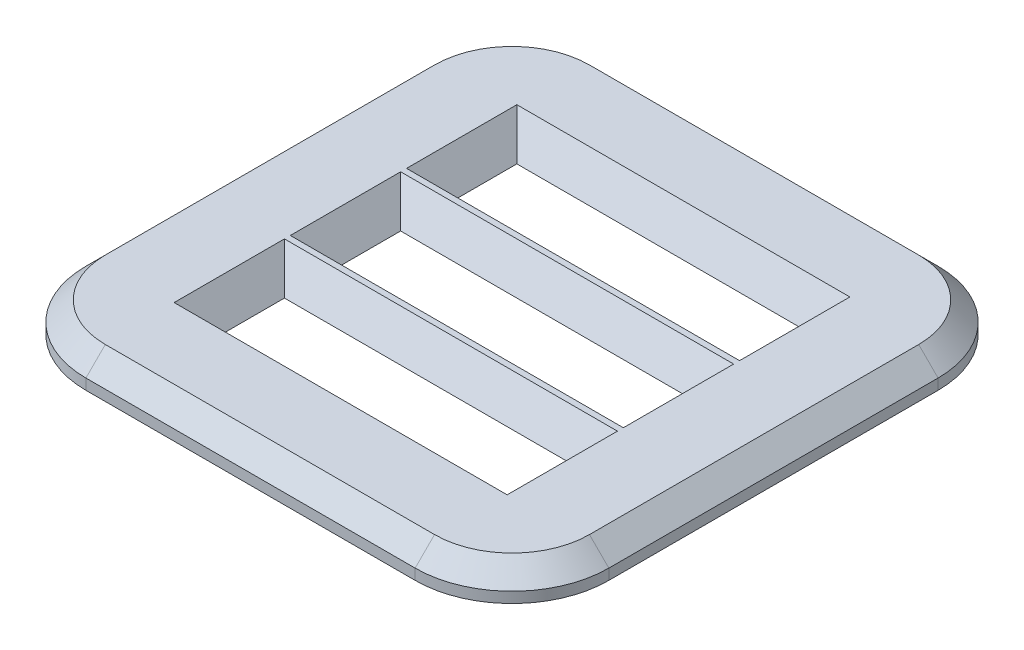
SolidWorks part; units mm, degrees
ref_plane "Front Plane" through (0, 0, 0) normal (0, 0, 1) x (1, 0, 0)
ref_plane "Top Plane" through (0, 0, 0) normal (0, 1, 0) x (1, 0, 0)
ref_plane "Right Plane" through (0, 0, 0) normal (1, 0, 0) x (0, 0, -1)
sketch "Sketch1" plane through (0, 0, 0) normal (0, 1, 0) x (1, 0, 0)
  line L1 (2.7, 2.7) -> (-2.7, 2.7)
  line L2 (2.7, 2.7) -> (2.7, -2.7)
  line L3 (2.7, -2.7) -> (-2.7, -2.7)
  line L4 (-2.7, 2.7) -> (-2.7, -2.7)
  line L5 (2.7, 2.7) -> (-2.7, -2.7) construction
  line L6 (2.7, -2.7) -> (-2.7, 2.7) construction
  point P0 (0, 0)
  dimension "D1" = 5.4
  dimension "D2" = 5.4
extrude "Boss-Extrude1" add sketch "Sketch1" along normal blind 0.31
fillet "Fillet1" radius 1 4 edges at (-2.7, 0.155, -2.7) (2.7, 0.155, -2.7) (2.7, 0.155, 2.7) (-2.7, 0.155, 2.7)
chamfer "Chamfer1" distance 0.2 angle 45 8 edges at (2.4071, 0.31, 2.4071) (0, 0.31, 2.7) (-2.4071, 0.31, 2.4071) (-2.7, 0.31, 0) (-2.4071, 0.31, -2.4071) (0, 0.31, -2.7) (2.4071, 0.31, -2.4071) (2.7, 0.31, 0)
sketch "Sketch2" plane through (0, 0.31, 0) normal (0, 1, 0) x (1, 0, 0)
  line L0 (-1.8586, 0.6) -> (1.8881, 0.6) construction
  line L1 (1.5, 0.35) -> (-1.5, 0.35)
  line L2 (1.5, 0.35) -> (1.5, -0.35)
  line L3 (1.5, -0.35) -> (-1.5, -0.35)
  line L4 (-1.5, 0.35) -> (-1.5, -0.35)
  line L5 (1.5, 0.35) -> (-1.5, -0.35) construction
  line L6 (1.5, -0.35) -> (-1.5, 0.35) construction
  line L7 (-1.7, 2.7) -> (1.7, 2.7) construction
  line L8 (-2.5, 0) -> (2.5, 0) construction
  line L9 (-2.5, 1.7) -> (-2.5, -1.7) construction
  line L10 (2.5, -1.7) -> (2.5, 1.7) construction
  line L15 (2.7, 1.7) -> (2.7, -1.7) construction
  line L16 (1.5, 1.55) -> (-1.5, 1.55)
  line L17 (-1.5, 0.85) -> (-1.5, 1.55)
  line L18 (1.5, 0.85) -> (-1.5, 0.85)
  line L19 (1.5, 0.85) -> (1.5, 1.55)
  line L20 (1.5, -0.85) -> (1.5, -1.55)
  line L21 (1.5, -0.85) -> (-1.5, -0.85)
  line L22 (-1.5, -0.85) -> (-1.5, -1.55)
  line L23 (1.5, -1.55) -> (-1.5, -1.55)
  point P0 (0, 0)
  point P20 (0, 0)
  dimension "D1" = 3
  dimension "D2" = 0.7
  dimension "D3" = 2.35
  dimension "D4" = 2.7
  dimension "D5" = 0.25
extrude "Cut-Extrude1" cut sketch "Sketch2" against normal through all
chamfer "Chamfer2" distance 0.31 angle 35.3 12 edges at (1.5, 0.31, 0) (0, 0.31, 0.35) (-1.5, 0.31, 0) (0, 0.31, -0.35) (0, 0.31, -1.55) (-1.5, 0.31, -1.2) (-1.5, 0.31, 1.2) (0, 0.31, 1.55) (1.5, 0.31, 1.2) (0, 0.31, 0.85) (1.5, 0.31, -1.2) (0, 0.31, -0.85)
